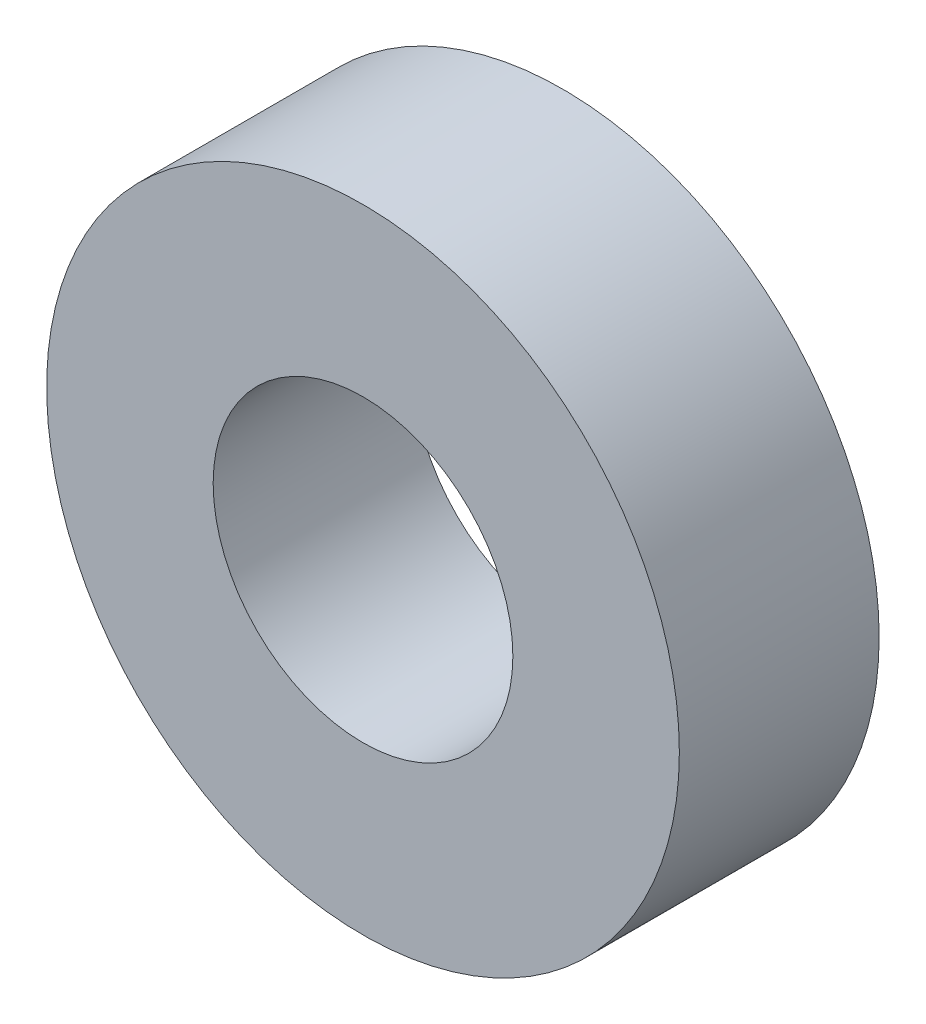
SolidWorks part; units mm, degrees
ref_plane "Front Plane" through (0, 0, 0) normal (0, 0, 1) x (1, 0, 0)
ref_plane "Top Plane" through (0, 0, 0) normal (0, 1, 0) x (1, 0, 0)
ref_plane "Right Plane" through (0, 0, 0) normal (1, 0, 0) x (0, 0, -1)
sketch "Sketch1" plane through (0, 0, 0) normal (0, 0, 1) x (1, 0, 0)
  circle A0 centre (0, 0) radius 2.7
  circle A1 centre (0, 0) radius 5.7
  dimension "D1" = 5.4
  dimension "D2" = 3
extrude "Boss-Extrude1" add sketch "Sketch1" along normal blind 3.6
